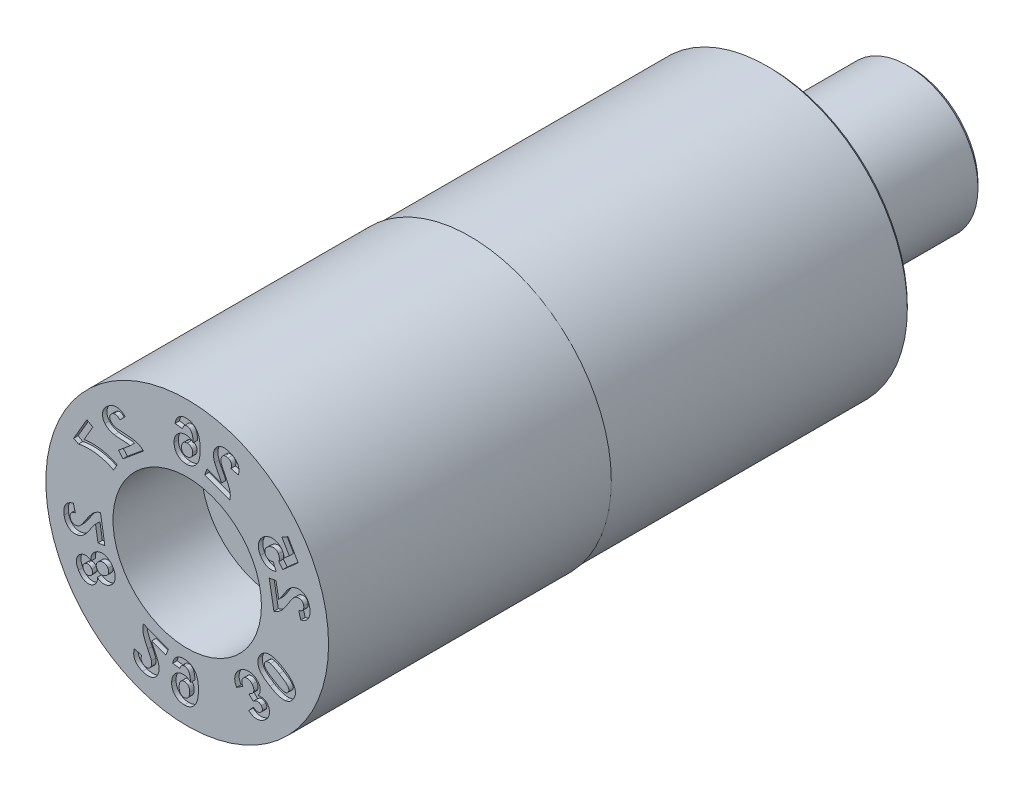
SolidWorks part; units mm, degrees
other "<M8 X 1.25 SHSS>-<Revolve1>"
ref_plane "Front Plane" through (0, 0, 0) normal (0, 0, 1) x (1, 0, 0)
ref_plane "Top Plane" through (0, 0, 0) normal (0, 1, 0) x (1, 0, 0)
ref_plane "Right Plane" through (0, 0, 0) normal (1, 0, 0) x (0, 0, -1)
sketch "Sketch1" plane through (0, 0, 0) normal (1, 0, 0) x (0, 0, -1)
  line L2 (0, 8) -> (0, 4.2)
  line L3 (32.75, 8) -> (0, 8)
  line L4 (-3.7979, 0) -> (49996.2021, 0) construction
  line L8 (25, 1.75) -> (5, 1.75)
  line L9 (5, 4.2) -> (5, 1.75)
  line L10 (5, 4.2) -> (0, 4.2)
  line L12 (33, 4) -> (33, 7.75)
  line L16 (33, 7.75) -> (32.75, 8)
  line L17 (33, 4) -> (25, 4)
  line L18 (25, 1.75) -> (25, 4)
  dimension "D1" = 33
  dimension "D2" = 45
  dimension "D3" = 0.25
  dimension "D4" = 16
  dimension "D5" = 8.4
  dimension "D6" = 5
  dimension "D7" = 3.5
  dimension "D8" = 8
  dimension "D9" = 8
revolve "Revolve1" add sketch "Sketch1" angle 360 about L4
sketch "Sketch4" plane through (0, 0, 0) normal (1, 0, 0) x (0, 0, -1)
  line L0 (0, 0) -> (50000, 0) construction
  line L1 (33, -7.75) -> (33, 7.75) construction
  line L2 (16, 8.935) -> (33, 8.935)
  line L3 (16, 8.935) -> (16, 7.935)
  line L4 (16, 7.935) -> (33, 7.935)
  line L5 (33, 8.935) -> (33, 7.935)
  line L6 (32.75, 8) -> (0, 8) construction
  line L9 (0, 8.8) -> (0, -8.8) construction
  dimension "D1" = 1
  dimension "D2" = 0.065
  dimension "D3" = 16
revolve "Cut-Revolve1" cut sketch "Sketch4" angle 360 about L0
sketch "Sketch2" plane through (0, 0, 0) normal (0, 0, 1) x (1, 0, 0)
  line L0 (0, 0) -> (0, 10.0042) construction
  line L1 (0, 0) -> (8.6639, 5.0021) construction
  line L2 (0, 0) -> (8.6639, -5.0021) construction
  line L3 (0, 0) -> (0, -10.0042) construction
  line L4 (0, 0) -> (-8.6639, -5.0021) construction
  line L5 (0, 0) -> (-8.6639, 5.0021) construction
  circle A0 centre (0, 0) radius 4.9201 construction
  text T0 "25  26  27  28  29  30" font "Arial" height 2.22
  point P11 (0, 0)
  point P1959 (0, 0.0125)
  point P1960 (0.0125, 0.0125)
  point P1961 (0.0125, 0)
  dimension "D1" = 6
extrude "Cut-Extrude1" cut sketch "Sketch2" against normal blind 0.25
sketch "Sketch3" plane through (0, 0, -5) normal (0, 0, 1) x (1, 0, 0)
  line L0 (0, 0) -> (0, 50000) construction
  line L1 (1.0104, 1.75) -> (-1.0104, 1.75)
  line L2 (-1.0104, 1.75) -> (-2.0207, 0)
  line L3 (-2.0207, 0) -> (-1.0104, -1.75)
  line L4 (-1.0104, -1.75) -> (1.0104, -1.75)
  line L5 (1.0104, -1.75) -> (2.0207, 0)
  line L6 (2.0207, 0) -> (1.0104, 1.75)
  line L7 (0, 0) -> (50000, 0) construction
  circle A0 centre (0, 0) radius 1.75 construction
  circle A1 centre (0, 0) radius 1.75 construction
extrude "Cut-Extrude2" cut sketch "Sketch3" against normal blind 4
inserted part "M8 X 1.25 SHSS"
move or copy body "Body-Move/Copy2" placed by mates yes
